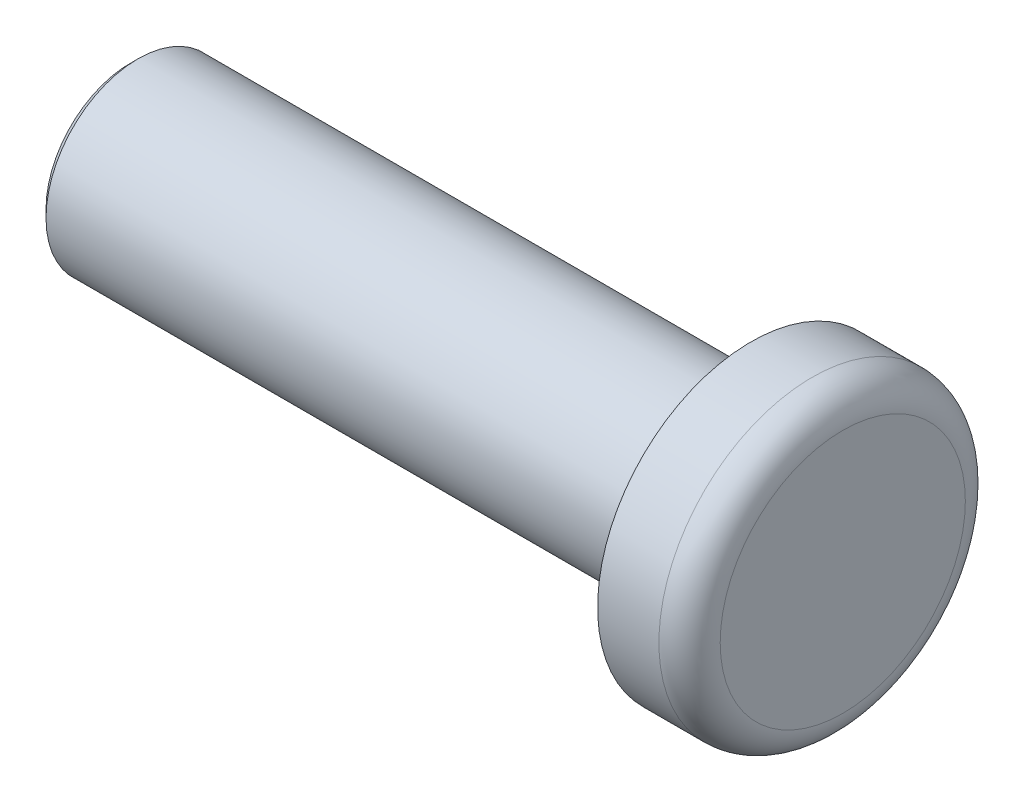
SolidWorks part; units mm, degrees
ref_plane "Спереди" through (0, 0, 0) normal (0, 0, 1) x (1, 0, 0)
ref_plane "Сверху" through (0, 0, 0) normal (0, 1, 0) x (1, 0, 0)
ref_plane "Справа" through (0, 0, 0) normal (1, 0, 0) x (0, 0, -1)
sketch "Эскиз1" plane through (0, 0, 0) normal (1, 0, 0) x (0, 0, -1)
  circle A0 centre (0, 0) radius 5
  dimension "D1" = 10
extrude "Бобышка-Вытянуть1" add sketch "Эскиз1" along normal blind 3
sketch "Эскиз2" plane through (0, 0, 0) normal (-1, 0, 0) x (0, 0, 1)
  circle A0 centre (0, 0) radius 3
  dimension "D1" = 6
extrude "Бобышка-Вытянуть2" add sketch "Эскиз2" along normal blind 20.25
fillet "Скругление1" radius 1 1 edges at (3, 0, -5)
chamfer "Фаска1" distance 0.25 angle 45 2 edges at (0, 0, -3) (-20.25, 0, 3)
